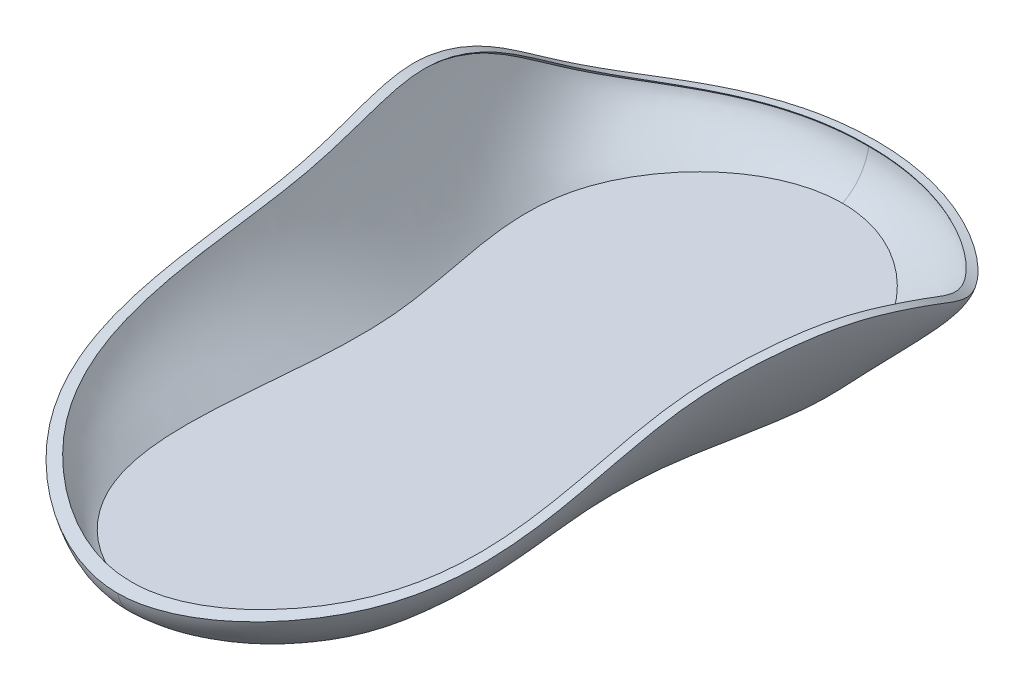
SolidWorks part; units mm, degrees
ref_plane "Front Plane" through (0, 0, 0) normal (0, 0, 1) x (1, 0, 0)
ref_plane "Top Plane" through (0, 0, 0) normal (0, 1, 0) x (1, 0, 0)
ref_plane "Right Plane" through (0, 0, 0) normal (1, 0, 0) x (0, 0, -1)
body saved out of another part "Stock-Mouse_Master_Model-1"
